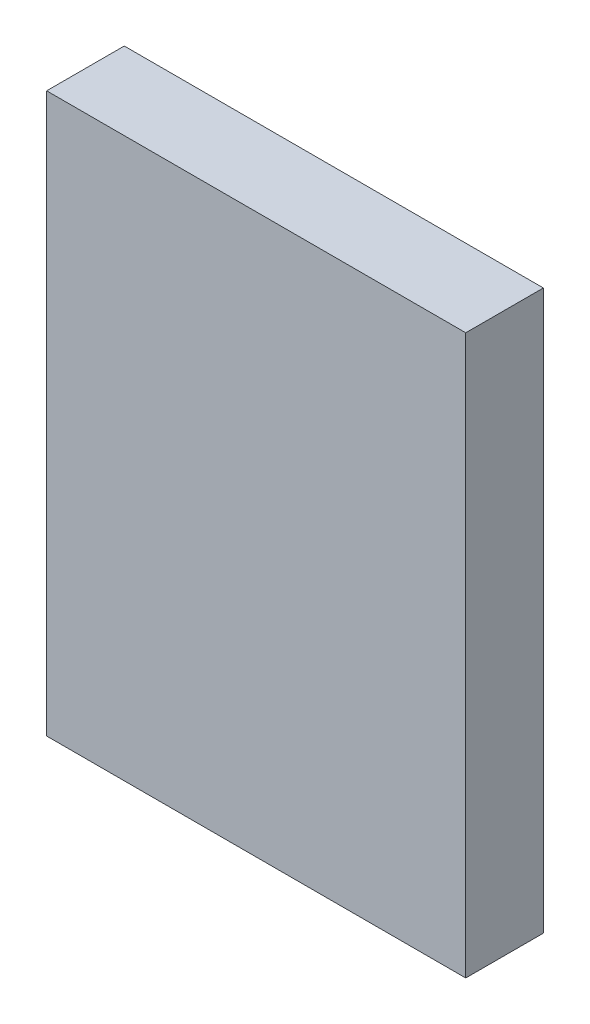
SolidWorks part; units mm, degrees
ref_plane "Přední" through (0, 0, 0) normal (0, 0, 1) x (1, 0, 0)
ref_plane "Horní" through (0, 0, 0) normal (0, 1, 0) x (1, 0, 0)
ref_plane "Pravá" through (0, 0, 0) normal (1, 0, 0) x (0, 0, -1)
sketch "Skica1" plane through (0, 0, 0) normal (0, 0, 1) x (1, 0, 0)
  line L0 (13.5, 18) -> (-13.5, -18) construction
  line L1 (-13.5, 18) -> (13.5, 18)
  line L2 (-13.5, 18) -> (-13.5, -18)
  line L3 (-13.5, -18) -> (13.5, -18)
  line L4 (13.5, 18) -> (13.5, -18)
  dimension "D1" = 36
  dimension "D2" = 27
extrude "Vysunout1" add sketch "Skica1" along normal blind 5
